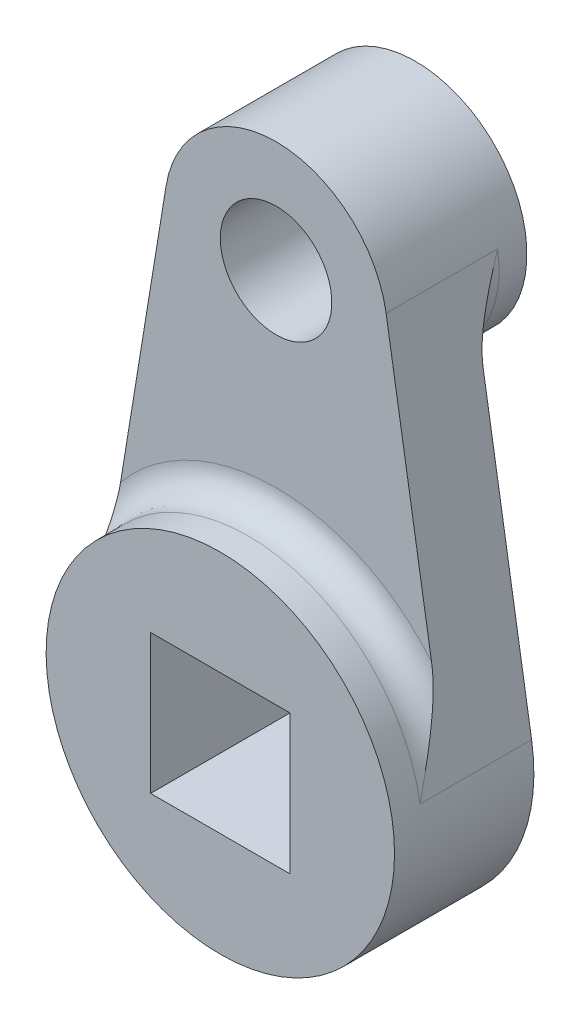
SolidWorks part; units mm, degrees
ref_plane "Front Plane" through (0, 0, 0) normal (0, 0, 1) x (1, 0, 0)
ref_plane "Top Plane" through (0, 0, 0) normal (0, 1, 0) x (1, 0, 0)
ref_plane "Right Plane" through (0, 0, 0) normal (1, 0, 0) x (0, 0, -1)
sketch "Sketch1" plane through (0, 0, 0) normal (0, 0, 1) x (1, 0, 0)
  line L0 (-200.5586, 743.8571) -> (-313.3728, 51.0268)
  line L1 (-127, -127) -> (127, -127)
  line L2 (-127, -127) -> (-127, 127)
  line L3 (-127, 127) -> (127, 127)
  line L4 (127, -127) -> (127, 127)
  line L5 (-127, -127) -> (127, 127) construction
  line L6 (-127, 127) -> (127, -127) construction
  line L7 (200.5586, 743.8571) -> (313.3728, 51.0268)
  arc A2 (-313.3728, 51.0268) -> (313.3728, 51.0268) centre (0, 0) ccw
  arc A3 (200.5586, 743.8571) -> (-200.5586, 743.8571) centre (0, 711.2) ccw
  circle A4 centre (0, 711.2) radius 101.6
  point P0 (0, 0)
  dimension "D3" = 317.5
  dimension "D4" = 203.2
  dimension "D6" = 203.2
  dimension "D1" = 254
  dimension "D2" = 254
  dimension "D5" = 711.2
extrude "Boss-Extrude1" add sketch "Sketch1" along normal blind 152.4
sketch "Sketch4" plane through (0, 0, 152.4) normal (0, 0, 1) x (1, 0, 0)
  line L0 (127, -127) -> (127, 127) construction
  line L1 (127, 127) -> (-127, 127) construction
  line L2 (-127, 127) -> (-127, -127) construction
  line L3 (-127, -127) -> (127, -127) construction
  line L4 (127, -127) -> (127, 127)
  line L5 (127, 127) -> (-127, 127)
  line L6 (-127, 127) -> (-127, -127)
  line L7 (-127, -127) -> (127, -127)
  circle A0 centre (0, 0) radius 317.5
  arc A1 (-313.3728, 51.0268) -> (313.3728, 51.0268) centre (0, 0) ccw construction
extrude "Boss-Extrude4" add sketch "Sketch4" along normal blind 101.6
sketch "Sketch5" plane through (0, 0, 0) normal (0, 0, -1) x (-1, 0, 0)
  circle A0 centre (0, 711.2) radius 101.6 construction
  circle A1 centre (0, 711.2) radius 101.6
  circle A2 centre (0, 711.2) radius 203.2
  arc A3 (200.5586, 743.8571) -> (-200.5586, 743.8571) centre (0, 711.2) ccw construction
extrude "Boss-Extrude5" add sketch "Sketch5" along normal blind 101.6
fillet "Fillet2" radius 50.8 2 edges at (0, 508, 0) (0, 317.5, 152.4)
